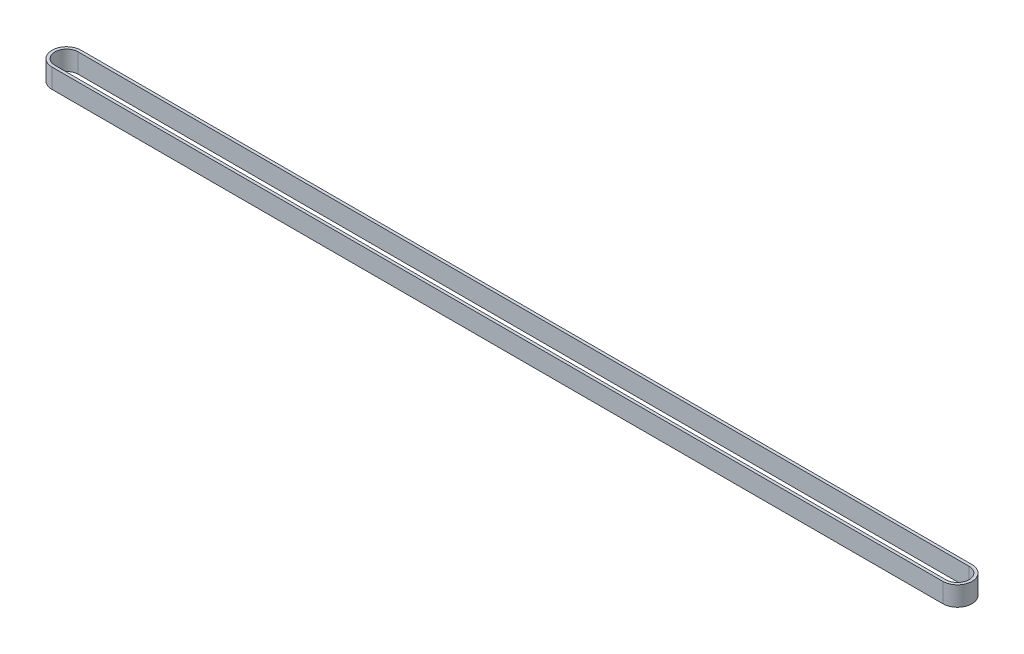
SolidWorks part; units mm, degrees
ref_plane "Ebene vorne" through (0, 0, 0) normal (0, 0, 1) x (1, 0, 0)
ref_plane "Ebene oben" through (0, 0, 0) normal (0, 1, 0) x (1, 0, 0)
ref_plane "Ebene rechts" through (0, 0, 0) normal (1, 0, 0) x (0, 0, -1)
sketch "Skizze1" plane through (0, 0, 0) normal (0, 1, 0) x (1, 0, 0)
  line L0 (458.8, -6.75) -> (0, -6.75) construction
  line L3 (0, 6.75) -> (458.8, 6.75) construction
  line L7 (458.8, -7.5) -> (0, -7.5)
  line L11 (458.8, -6) -> (0, -6)
  line L12 (-3.8114, 31.7366) -> (18.6161, 3.4686) construction
  line L13 (-2.9132, 31.8112) -> (19.0523, 4.1255) construction
  line L14 (-2.0069, 31.8755) -> (19.4893, 4.7814) construction
  line L15 (30.7206, 6) -> (0, 6) construction
  line L16 (30.4077, 6.75) -> (0, 6.75) construction
  line L17 (30.0882, 7.5) -> (0, 7.5) construction
  line L18 (0, 6) -> (458.8, 6) construction
  line L19 (0, 6) -> (458.8, 6)
  line L20 (458.8, 7.5) -> (0, 7.5)
  line L21 (0, 7.5) -> (458.8, 7.5) construction
  arc A0 (0, 6.75) -> (0, -6.75) centre (0, 0) ccw construction
  arc A1 (458.8, -6.75) -> (458.8, 6.75) centre (458.8, 0) ccw construction
  arc A4 (458.8, -7.5) -> (458.8, 7.5) centre (458.8, 0) ccw
  arc A7 (0, 7.5) -> (0, -7.5) centre (0, 0) ccw
  arc A8 (458.8, -6) -> (458.8, 6) centre (458.8, 0) ccw
  arc A11 (0, 6) -> (0, -6) centre (0, 0) ccw
  arc A12 (0, 6) -> (18.6161, 3.4686) centre (0, -63.7168) ccw construction
  arc A13 (0, 6.75) -> (19.0523, 4.1255) centre (0, -63.7168) ccw construction
  arc A14 (0, 7.5) -> (19.4893, 4.7814) centre (0, -63.7168) ccw construction
  arc A15 (30.7206, 6) -> (-3.8114, 31.7366) centre (15.3618, 21.4272) ccw construction
  arc A16 (30.4077, 6.75) -> (-2.9132, 31.8112) centre (15.3618, 21.4272) ccw construction
  arc A17 (30.0882, 7.5) -> (-2.0069, 31.8755) centre (15.3618, 21.4272) ccw construction
  dimension "D1" = 13.5
  dimension "D3" = 458.8
  dimension "D7" = 0.75
  dimension "D8" = 0.75
extrude "Aufsatz-Linear austragen1" add sketch "Skizze1" along normal mid plane 10
